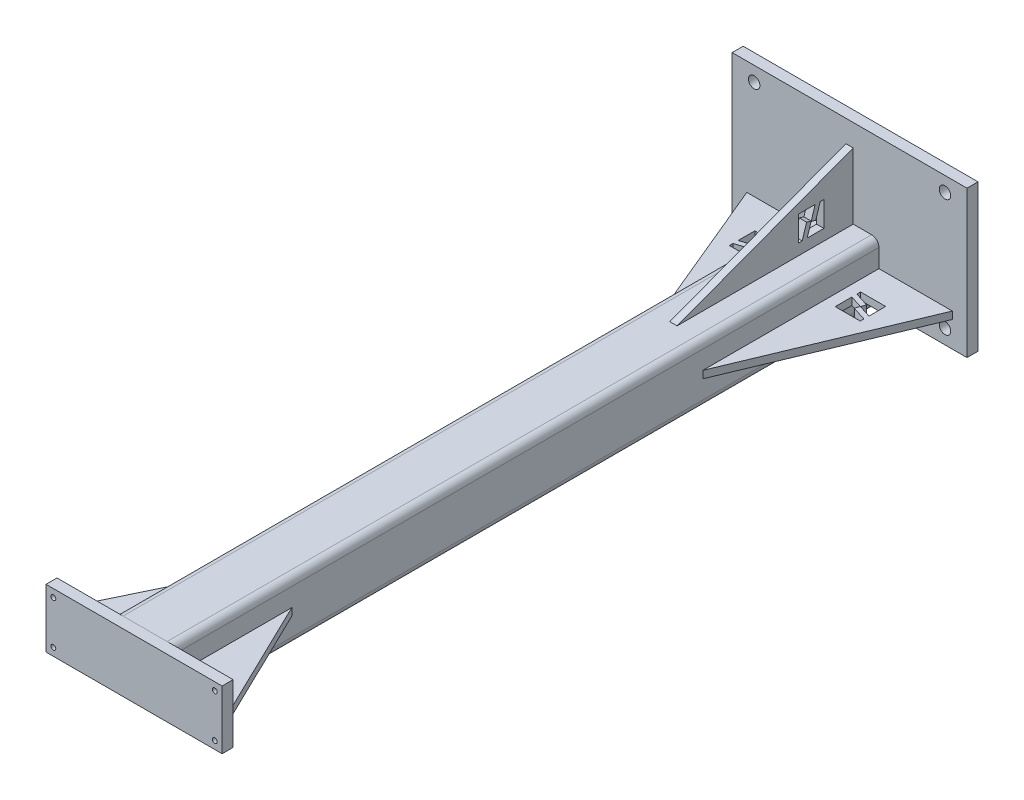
SolidWorks part; units mm, degrees
ref_plane "Front Plane" through (0, 0, 0) normal (0, 0, 1) x (1, 0, 0)
ref_plane "Top Plane" through (0, 0, 0) normal (0, 1, 0) x (1, 0, 0)
ref_plane "Right Plane" through (0, 0, 0) normal (1, 0, 0) x (0, 0, -1)
sketch3d "3DSketch1"
  line L0 (0, 0, 0) -> (0, 0, -1219.2)
  dimension "D3" = 1219.2
other "Tube (square) TS4X4X0.25(4)"
ref_plane "Plane1" through (0, 0, 0) normal (0, 0, -1) x (1, 0, 0)
sketch "Sketch1" plane through (0, 0, 0) normal (0, 0, -1) x (1, 0, 0)
  line L0 (-38.1, -44.45) -> (38.1, -44.45)
  line L1 (-44.45, -38.1) -> (-44.45, 38.1)
  line L2 (38.1, 44.45) -> (-38.1, 44.45)
  line L3 (44.45, 38.1) -> (44.45, -38.1)
  line L4 (-38.1, -50.8) -> (38.1, -50.8)
  line L5 (-50.8, -38.1) -> (-50.8, 38.1)
  line L6 (38.1, 50.8) -> (-38.1, 50.8)
  line L7 (50.8, 38.1) -> (50.8, -38.1)
  line L8 (-50.8, 0) -> (-44.45, 0) construction
  line L9 (-44.45, 0) -> (44.45, 0) construction
  line L10 (44.45, 0) -> (50.8, 0) construction
  line L11 (0, 50.8) -> (0, 44.45) construction
  line L12 (0, 44.45) -> (0, -44.45) construction
  line L13 (0, -44.45) -> (0, -50.8) construction
  arc A0 (50.8, 38.1) -> (38.1, 50.8) centre (38.1, 38.1) ccw
  arc A1 (38.1, -50.8) -> (50.8, -38.1) centre (38.1, -38.1) ccw
  arc A2 (-50.8, -38.1) -> (-38.1, -50.8) centre (-38.1, -38.1) ccw
  arc A3 (-38.1, 50.8) -> (-50.8, 38.1) centre (-38.1, 38.1) ccw
  arc A4 (-38.1, 44.45) -> (-44.45, 38.1) centre (-38.1, 38.1) ccw
  arc A5 (44.45, 38.1) -> (38.1, 44.45) centre (38.1, 38.1) ccw
  arc A6 (38.1, -44.45) -> (44.45, -38.1) centre (38.1, -38.1) ccw
  arc A7 (-44.45, -38.1) -> (-38.1, -44.45) centre (-38.1, -38.1) ccw
  point P6 (-50.8, -50.8)
  point P33 (-50.8, 50.8)
  point P35 (50.8, 50.8)
  point P36 (50.8, -50.8)
  point P37 (0, 0)
  dimension "D1" = 12.7
  dimension "Thickness" = 6.35
  dimension "V_leg" = 101.6
  dimension "H_leg" = 101.6
other "End cap1" [suppressed] parameters "D1"=6.35, "D2"=3.175, "D3"=3.175, "D4"=0
sketch "Sketch12" plane through (0, 0, -1219.2) normal (0, 0, -1) x (-1, 0, 0)
  line L0 (0, 203.2) -> (0, -50.8) construction
  line L1 (38.1, 50.8) -> (-38.1, 50.8) construction
  line L3 (-38.1, -50.8) -> (38.1, -50.8) construction
  line L4 (-203.2, 203.2) -> (203.2, 203.2)
  line L5 (-203.2, 203.2) -> (-203.2, -50.8)
  line L6 (-203.2, -50.8) -> (203.2, -50.8)
  line L7 (203.2, 203.2) -> (203.2, -50.8)
  line L8 (-203.2, 203.2) -> (203.2, -50.8) construction
  line L9 (-203.2, -50.8) -> (203.2, 203.2) construction
  line L12 (0, 381.889) -> (0, 50.8) construction
  point P6 (0, 76.2)
  dimension "D1" = 254
  dimension "D2" = 406.4
extrude "Boss-Extrude1" add sketch "Sketch12" along normal blind 19.05 separate body
hole_wizard "3/4 Clearance Hole1" positions "Sketch13" profile "Sketch14" hole size "3/4" standard "ANSI Inch"
sketch "Sketch13" plane through (0, 0, -1219.2) normal (0, 0, 1) x (1, 0, 0)
  line L0 (-203.2, 76.2) -> (299.7541, 76.2) construction
  line L1 (-203.2, -50.8) -> (-203.2, 203.2) construction
  line L3 (0, -50.8) -> (0, 201.525) construction
  line L4 (203.2, -50.8) -> (-203.2, -50.8) construction
  line L6 (-203.2, 203.2) -> (203.2, 203.2) construction
  point P0 (-165.1, 177.8)
  point P17 (-165.1, -25.4)
  point P19 (165.1, -25.4)
  point P20 (165.1, 177.8)
  dimension "D1" = 38.1
  dimension "D2" = 25.4
sketch "Sketch14" plane through (-165.1, 177.8, -1219.2) normal (1, 0, 0) x (0, -1, 0)
  line L0 (0, 0) -> (0, 19.05)
  line L1 (0, 19.05) -> (9.9212, 19.05)
  line L2 (9.9212, 19.05) -> (9.9212, 0)
  line L5 (9.9212, 0) -> (0, 0)
  line L11 (0, -6.35) -> (0, 107.95) construction
  dimension "Thru Hole Dia." = 19.8425
  dimension "Thru Hole Depth" = 19.05
move or copy body "Body-Move/Copy1" [suppressed] bodies to move or copy 105 copy no translate (-31.75, 0, 0)
mirror "Mirror6" [suppressed] about plane through (0, 0, 0) normal (1, 0, 0)
other "Gusset1" parameters "D1"=12.7, "D2"=6.35, "D3"=0, "D4"=0, "D10"=6.35, "D11"=304.8, "D12"=127, "D13"=12.7, "D14"=67.751, "D15"=12.7, "D16"=76.2, "D17"=34.925, "D18"=24.624
sketch "Sketch132" plane through (-50.8, 0, -1219.2) normal (0, -1, 0) x (-1, 0, 0)
  line L0 (0, 0) -> (0, -304.8)
  line L1 (0, 0) -> (127, 0)
  line L2 (0, -304.8) -> (127, 0)
sketch "Sketch134" plane through (0, 6.35, 0) normal (0, 1, 0) x (1, 0, 0)
  line L0 (-177.8, 1219.2) -> (-50.8, 1219.2) construction
  line L1 (-50.8, 1219.2) -> (-50.8, 914.4) construction
  line B0 (-91.3476, 1146.4689) -> (-88.9288, 1138.4932)
  line B1 (-88.9288, 1138.4932) -> (-113.2505, 1130.822)
  line B2 (-113.2505, 1130.822) -> (-113.2505, 1124.4281)
  line B3 (-113.2505, 1124.4281) -> (-69.85, 1124.4281)
  line B4 (-69.85, 1124.4281) -> (-69.85, 1153.3015)
  line B5 (-69.85, 1153.3015) -> (-91.3476, 1146.4689)
  line B6 (-91.7733, 1146.328) -> (-94.1819, 1154.3037)
  line B7 (-94.1819, 1154.3037) -> (-69.85, 1161.9749)
  line B8 (-69.85, 1161.9749) -> (-69.85, 1168.4)
  line B9 (-69.85, 1168.4) -> (-113.2388, 1168.4)
  line B10 (-113.2388, 1168.4) -> (-113.3146, 1139.511)
  line B11 (-113.3146, 1139.511) -> (-91.7733, 1146.328)
  dimension "D1" = 50.8
  dimension "D2" = 19.05
sketch_block_instance "Block2-1"
sketch_block "Block2"
extrude "Cut-Extrude1" cut sketch "Sketch134" against normal through all
other "Gusset2" parameters "D1"=12.7, "D2"=6.35, "D3"=0, "D4"=0, "D10"=6.35, "D11"=304.8, "D12"=114.3, "D13"=12.7, "D14"=74.745, "D15"=12.7, "D16"=76.2, "D17"=31.75, "D18"=22.62
sketch "Sketch133" plane through (0, 50.8, -1219.2) normal (-1, 0, 0) x (0, 0, 1)
  line L0 (0, 0) -> (304.8, 0)
  line L1 (0, 0) -> (0, 114.3)
  line L2 (304.8, 0) -> (0, 114.3)
sketch "Sketch135" plane through (-6.35, 0, 0) normal (-1, 0, 0) x (0, 0, 1)
  line L0 (-1219.2, 165.1) -> (-1219.2, 50.8) construction
  line L1 (-1219.2, 50.8) -> (-914.4, 50.8) construction
  line B0 (-1146.3592, 91.3476) -> (-1154.3349, 88.9288)
  line B1 (-1154.3349, 88.9288) -> (-1162.0061, 113.2505)
  line B2 (-1162.0061, 113.2505) -> (-1168.4, 113.2505)
  line B3 (-1168.4, 113.2505) -> (-1168.4, 69.85)
  line B4 (-1168.4, 69.85) -> (-1139.5266, 69.85)
  line B5 (-1139.5266, 69.85) -> (-1146.3592, 91.3476)
  line B6 (-1146.5001, 91.7733) -> (-1138.5244, 94.1819)
  line B7 (-1138.5244, 94.1819) -> (-1130.8532, 69.85)
  line B8 (-1130.8532, 69.85) -> (-1124.4281, 69.85)
  line B9 (-1124.4281, 69.85) -> (-1124.4281, 113.2388)
  line B10 (-1124.4281, 113.2388) -> (-1153.3171, 113.3146)
  line B11 (-1153.3171, 113.3146) -> (-1146.5001, 91.7733)
  dimension "D1" = 50.8
  dimension "D2" = 19.05
sketch_block_instance "Block2-2"
extrude "Cut-Extrude2" cut sketch "Sketch135" against normal through all
ref_plane "Plane2" through (0, 0, 0) normal (-1, 0, 0) x (0, 0, 1)
mirror "Mirror3" about plane through (0, 0, 0) normal (-1, 0, 0)
sketch "Sketch136" plane through (0, 0, 0) normal (0, 0, 1) x (1, 0, 0)
  line L0 (-38.1, 50.8) -> (38.1, 50.8) construction
  line L1 (38.1, -50.8) -> (-38.1, -50.8) construction
  line L2 (0, -44.45) -> (0, -50.8) construction
  line L3 (38.1, -44.45) -> (-38.1, -44.45) construction
  line L8 (-152.4, 50.8) -> (-152.4, -50.8)
  line L9 (-152.4, -50.8) -> (152.4, -50.8)
  line L10 (152.4, -50.8) -> (152.4, 50.8)
  line L11 (152.4, 50.8) -> (-152.4, 50.8)
  dimension "D1" = 304.8
extrude "Boss-Extrude2" add sketch "Sketch136" along normal blind 19.05 separate body
hole_wizard "5/16 Clearance Hole1" positions "Sketch137" profile "Sketch138" hole size "5/16" standard "ANSI Inch"
sketch "Sketch137" plane through (0, 0, 0) normal (0, 0, -1) x (-1, 0, 0)
  line L0 (139.7, 37.3126) -> (-200.66, 37.3126) construction
  line L3 (-200.66, -37.3126) -> (139.7, -37.3126) construction
  line L6 (139.7, 37.3126) -> (139.7, -37.3126) construction
  line L8 (152.4, 50.8) -> (152.4, -50.8) construction
  line L9 (-200.66, -43.3937) -> (-200.66, -31.2315) construction
  line L10 (-200.66, 31.2315) -> (-200.66, 43.3937) construction
  point P0 (139.7, 37.3126)
  point P2 (139.7, -37.3126)
  dimension "D1" = 12.7
sketch "Sketch138" plane through (-139.7, 37.3126, 0) normal (1, 0, 0) x (0, 1, 0)
  line L0 (0, 0) -> (0, 19.05)
  line L1 (0, 19.05) -> (4.2164, 19.05)
  line L2 (4.2164, 19.05) -> (4.2164, 0)
  line L5 (4.2164, 0) -> (0, 0)
  line L11 (0, -6.35) -> (0, 107.95) construction
  dimension "Thru Hole Dia." = 8.4328
  dimension "Thru Hole Depth" = 19.05
mirror "Mirror4" about plane through (0, 0, 0) normal (-1, 0, 0) of "5/16 Clearance Hole1"
move or copy body "Body-Move/Copy2" [suppressed] bodies to move or copy 135 copy no translate (28.575, 0, 0)
sketch "Sketch139" plane through (0, 0, 0) normal (0, 1, 0) x (1, 0, 0)
  line L0 (143.9164, 0) -> (135.4836, 0) construction
  line L1 (149.225, 0) -> (50.8, 203.2)
  line L2 (152.4, -19.05) -> (152.4, 0) construction
  line L3 (50.8, 1219.2) -> (50.8, 0) construction
  line L4 (149.225, 0) -> (50.8, 0)
  line L5 (50.8, 0) -> (50.8, 203.2)
  dimension "D1" = 3.175
  dimension "D2" = 203.2
extrude "Boss-Extrude3" add sketch "Sketch139" along normal mid plane 12.7 separate body
mirror "Mirror5" about plane through (0, 0, 0) normal (-1, 0, 0)
hole_wizard "1/4-20 Tapped Hole1" positions "Sketch140" profile "Sketch141" tap size "1/4-20" standard "ANSI Inch"
sketch "Sketch140" plane through (0, 0, 12.7) normal (0, 0, 1) x (1, 0, 0)
  point P0 (69.3356, -22.6187)
  point P3 (147.9105, -22.6187)
  point P6 (147.9105, 22.6187)
  point P9 (69.3356, 22.6187)
  point P12 (-75.6857, -22.6187)
  point P15 (-75.6857, 22.6187)
  point P18 (-154.2606, -22.6187)
  point P27 (-154.2606, 22.6187)
sketch "Sketch141" plane through (69.3356, -22.6187, 12.7) normal (1, 0, 0) x (0, -1, 0)
  line L0 (0, 0) -> (0, 482.6)
  line L1 (0, 482.6) -> (2.5527, 482.6)
  line L2 (2.5527, 482.6) -> (2.5527, 0)
  line L5 (2.5527, 0) -> (0, 0)
  line L11 (0, -6.35) -> (0, 107.95) construction
  dimension "Thru Tap Drill Dia." = 5.1054
  dimension "Thru Tap Drill Depth" = 482.6
delete or keep bodies "Body-Delete/Keep 1" [suppressed] type delete bodies bodies 137 138 139
sketch "Sketch142" [suppressed] plane through (0, -50.8, 0) normal (0, 1, 0) x (1, 0, 0)
  line L0 (-38.1, 0) -> (38.1, 0) construction
  line L1 (50.8, 0) -> (-50.8, 0)
  line L2 (50.8, 0) -> (50.8, 210.6422)
  line L3 (50.8, 210.6422) -> (-50.8, 210.6422)
  line L4 (-50.8, 0) -> (-50.8, 210.6422)
  line L5 (50.8, 0) -> (-50.8, 210.6422) construction
  line L6 (50.8, 210.6422) -> (-50.8, 0) construction
  line L7 (0, 105.3211) -> (0, 0) construction
  line L8 (38.1, 0) -> (-38.1, 0) construction
  point P0 (0, 105.3211)
  dimension "D1" = 210.6422
  dimension "D2" = 101.6
extrude "Boss-Extrude4" [suppressed] add sketch "Sketch142" against normal blind 12.7 separate body
other "End cap2" [suppressed] parameters "D1"=6.35, "D2"=3.175, "D3"=3.175, "D4"=0
hole_wizard "#10 Clearance Hole2" positions "Sketch143" profile "Sketch144" hole size "#10" standard "ANSI Inch"
sketch "Sketch143" plane through (0, -50.8, 0) normal (0, 1, 0) x (1, 0, 0)
  line L0 (-50.8, 6.7628) -> (-41.275, 6.7628) construction
  line L2 (-50.8, 48.8252) -> (-41.275, 48.8252) construction
  line L7 (-41.275, 6.7628) -> (-41.275, 48.8252) construction
  line L9 (-50.8, 105.3211) -> (-102.5494, 105.3211) construction
  line L10 (-50.8, 210.6422) -> (-50.8, 0) construction
  line L12 (0, 0) -> (0, -123.7907) construction
  line L13 (38.1, 0) -> (-38.1, 0) construction
  line L14 (-41.275, 27.794) -> (-50.8, 27.794) construction
  line L16 (-41.275, 27.794) -> (-50.8, 27.794) construction
  line L18 (-50.8, 762) -> (-50.8, 0) construction
  point P0 (-41.275, 6.7628)
  point P6 (-41.275, 48.8252)
  point P33 (-41.275, 203.8794)
  point P34 (-41.275, 161.817)
  point P42 (41.275, 203.8794)
  point P43 (41.275, 161.817)
  point P44 (41.275, 48.8252)
  point P45 (41.275, 6.7628)
sketch "Sketch144" plane through (-41.275, -50.8, -6.7628) normal (1, 0, 0) x (0, 0, 1)
  line L0 (0, 0) -> (0, 12.7)
  line L1 (0, 12.7) -> (2.5527, 12.7)
  line L2 (2.5527, 12.7) -> (2.5527, 0)
  line L5 (2.5527, 0) -> (0, 0)
  line L11 (0, -6.35) -> (0, 107.95) construction
  dimension "Thru Hole Dia." = 5.1054
  dimension "Thru Hole Depth" = 12.7
hole_wizard "1/4-20 Tapped Hole2" positions "Sketch145" profile "Sketch146" tap size "1/4-20" standard "ANSI Inch"
sketch "Sketch145" plane through (0, -63.5, 0) normal (0, -1, 0) x (-1, 0, 0)
  point P0 (22.6187, 67.0814)
  point P3 (-22.6187, 67.0814)
  point P6 (-22.6187, 143.5735)
  point P9 (22.6187, 143.5735)
sketch "Sketch146" plane through (-22.6187, -63.5, -67.0814) normal (1, 0, 0) x (0, 0, -1)
  line L0 (0, 0) -> (0, 266.7)
  line L1 (0, 266.7) -> (2.5527, 266.7)
  line L2 (2.5527, 266.7) -> (2.5527, 0)
  line L5 (2.5527, 0) -> (0, 0)
  line L11 (0, -6.35) -> (0, 107.95) construction
  dimension "Thru Tap Drill Dia." = 5.1054
  dimension "Thru Tap Drill Depth" = 266.7
sketch "Sketch147" [suppressed] plane through (0, -63.5, 0) normal (0, -1, 0) x (-1, 0, 0)
  line L1 (6.604, 77.0001) -> (-6.604, 77.0001)
  line L2 (6.604, 77.0001) -> (6.604, 133.6548)
  line L3 (6.604, 133.6548) -> (-6.604, 133.6548)
  line L4 (-6.604, 77.0001) -> (-6.604, 133.6548)
extrude "Cut-Extrude3" [suppressed] cut sketch "Sketch147" against normal up to surface (19.05 mm away)
fillet "Fillet1" [suppressed] radius 1.5875
mirror "Mirror7" [suppressed] about plane through (0, 0, 0) normal (1, 0, 0)
sketch "Sketch148" [suppressed] plane through (0, -3.175, 0) normal (0, -1, 0) x (1, 0, 0)
  line L0 (-19.05, 0) -> (-156.2354, 0) construction
  line L1 (-82.55, 0) -> (82.55, 0)
  line L2 (-82.55, 0) -> (-82.55, -228.6)
  line L3 (-82.55, -228.6) -> (82.55, -228.6)
  line L4 (82.55, 0) -> (82.55, -228.6)
  line L5 (-82.55, -457.2) -> (-82.55, 0) construction
  line L6 (82.55, -457.2) -> (82.55, 0) construction
  line L7 (-82.55, -457.2) -> (-82.55, 0) construction
extrude "Cut-Extrude4" [suppressed] cut sketch "Sketch148" against normal through all
sketch "Sketch149" [suppressed] plane through (0, 0, 0) normal (0, 0, 1) x (1, 0, 0)
  line L1 (6.35, 50.8) -> (-6.35, 50.8)
  line L2 (6.35, 50.8) -> (6.35, -50.8)
  line L3 (6.35, -50.8) -> (-6.35, -50.8)
  line L4 (-6.35, 50.8) -> (-6.35, -50.8)
extrude "Cut-Extrude5" [suppressed] cut sketch "Sketch149" against normal up to surface (457.2 mm away)
sketch "Sketch150" [suppressed] plane through (0, 0, 0) normal (0, 0, 1) x (1, 0, 0)
  line L1 (-12.7, 31.75) -> (12.7, 31.75)
  line L2 (-12.7, 31.75) -> (-12.7, 25.4)
  line L3 (-12.7, 25.4) -> (12.7, 25.4)
  line L4 (12.7, 31.75) -> (12.7, 25.4)
  line L5 (-12.7, -25.4) -> (12.7, -25.4)
  line L6 (-12.7, -25.4) -> (-12.7, -31.75)
  line L7 (-12.7, -31.75) -> (12.7, -31.75)
  line L8 (12.7, -25.4) -> (12.7, -31.75)
extrude "Boss-Extrude5" [suppressed] add sketch "Sketch150" against normal up to surface (457.2 mm away)
